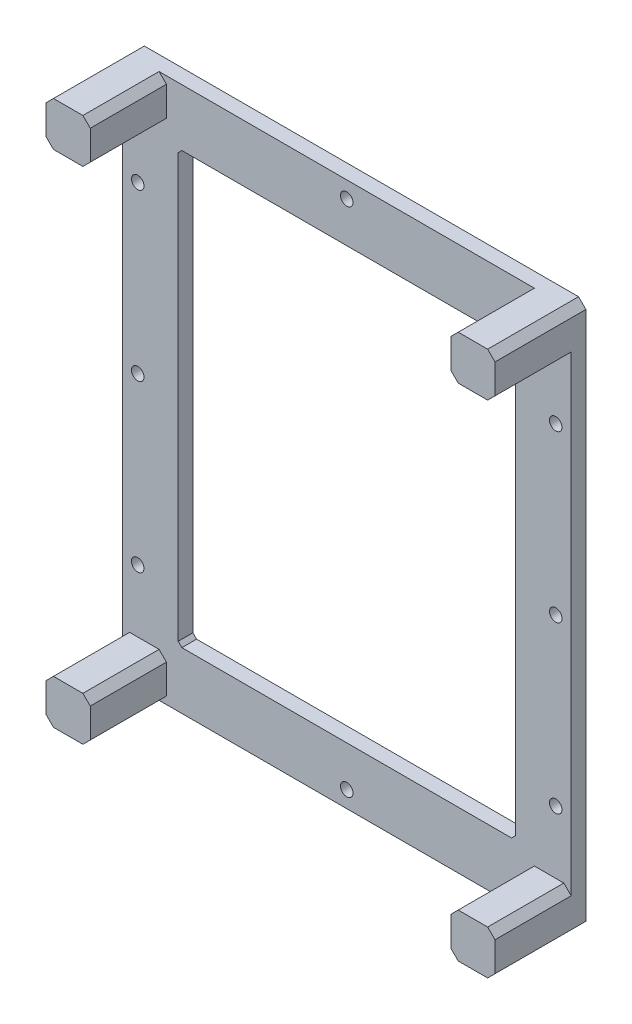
SolidWorks part; units mm, degrees
ref_plane "前视基准面" through (0, 0, 0) normal (0, 0, 1) x (1, 0, 0)
ref_plane "上视基准面" through (0, 0, 0) normal (0, 1, 0) x (1, 0, 0)
ref_plane "右视基准面" through (0, 0, 0) normal (1, 0, 0) x (0, 0, -1)
other "Configuration Table"
sketch "草图1" plane through (0, 0, 0) normal (0, 0, 1) x (1, 0, 0)
  line L0 (-59, -74) -> (59, -74)
  line L1 (59, -74) -> (61, -72)
  line L2 (61, -72) -> (61, 72)
  line L3 (61, 72) -> (59, 74)
  line L4 (59, 74) -> (-59, 74)
  line L5 (-59, 74) -> (-61, 72)
  line L6 (-61, 72) -> (-61, -72)
  line L7 (-61, -72) -> (-59, -74)
  line L8 (-44.8, -58.5) -> (44.8, -58.5)
  line L9 (44.8, -58.5) -> (45.8, -57.5)
  line L10 (45.8, -57.5) -> (45.8, 57.5)
  line L11 (45.8, 57.5) -> (44.8, 58.5)
  line L12 (44.8, 58.5) -> (-44.8, 58.5)
  line L13 (-44.8, 58.5) -> (-45.8, 57.5)
  line L14 (-45.8, 57.5) -> (-45.8, -57.5)
  line L15 (-45.8, -57.5) -> (-44.8, -58.5)
  circle A0 centre (-56.8, -45) radius 1.7
  circle A1 centre (-56.8, 0) radius 1.7
  circle A2 centre (-56.8, 45) radius 1.7
  circle A3 centre (56.8, -45) radius 1.7
  circle A4 centre (56.8, 0) radius 1.7
  circle A5 centre (56.8, 45) radius 1.7
  circle A6 centre (0, -69.5) radius 1.7
  circle A7 centre (0, 69.5) radius 1.7
  dimension "D1" = 3.4
  dimension "D2" = 44.8
  dimension "D3" = 45.8
  dimension "D4" = 56.8
  dimension "D5" = 59
  dimension "D6" = 61
  dimension "D7" = 44.8
  dimension "D8" = 56.8
  dimension "D9" = 59
  dimension "D10" = 45
  dimension "D11" = 57.5
  dimension "D12" = 58.5
  dimension "D13" = 69.5
  dimension "D14" = 72
  dimension "D15" = 74
  dimension "D16" = 45
  dimension "D17" = 57.5
  dimension "D18" = 69.5
  dimension "D19" = 72
extrude "Flat_ring_8_clearance_holes_outside_film" add sketch "草图1" along normal blind 4
sketch "草图2" plane through (0, 0, 0) normal (0, 0, 1) x (1, 0, 0)
  line L0 (-59, -74) -> (-51, -74)
  line L1 (-51, -74) -> (-49, -72)
  line L2 (-49, -72) -> (-49, -64)
  line L3 (-49, -64) -> (-51, -62)
  line L4 (-51, -62) -> (-59, -62)
  line L5 (-59, -62) -> (-61, -64)
  line L6 (-61, -64) -> (-61, -72)
  line L7 (-61, -72) -> (-59, -74)
  line L8 (-59, 62) -> (-51, 62)
  line L9 (-51, 62) -> (-49, 64)
  line L10 (-49, 64) -> (-49, 72)
  line L11 (-49, 72) -> (-51, 74)
  line L12 (-51, 74) -> (-59, 74)
  line L13 (-59, 74) -> (-61, 72)
  line L14 (-61, 72) -> (-61, 64)
  line L15 (-61, 64) -> (-59, 62)
  line L16 (51, -74) -> (59, -74)
  line L17 (59, -74) -> (61, -72)
  line L18 (61, -72) -> (61, -64)
  line L19 (61, -64) -> (59, -62)
  line L20 (59, -62) -> (51, -62)
  line L21 (51, -62) -> (49, -64)
  line L22 (49, -64) -> (49, -72)
  line L23 (49, -72) -> (51, -74)
  line L24 (51, 62) -> (59, 62)
  line L25 (59, 62) -> (61, 64)
  line L26 (61, 64) -> (61, 72)
  line L27 (61, 72) -> (59, 74)
  line L28 (59, 74) -> (51, 74)
  line L29 (51, 74) -> (49, 72)
  line L30 (49, 72) -> (49, 64)
  line L31 (49, 64) -> (51, 62)
  dimension "D1" = 49
  dimension "D2" = 59
  dimension "D3" = 61
  dimension "D4" = 49
  dimension "D5" = 62
  dimension "D6" = 64
  dimension "D7" = 64
extrude "Four_fixed_feet_film_plane_matches_receiver_face" add sketch "草图2" along normal blind 20.7 from offset 4
